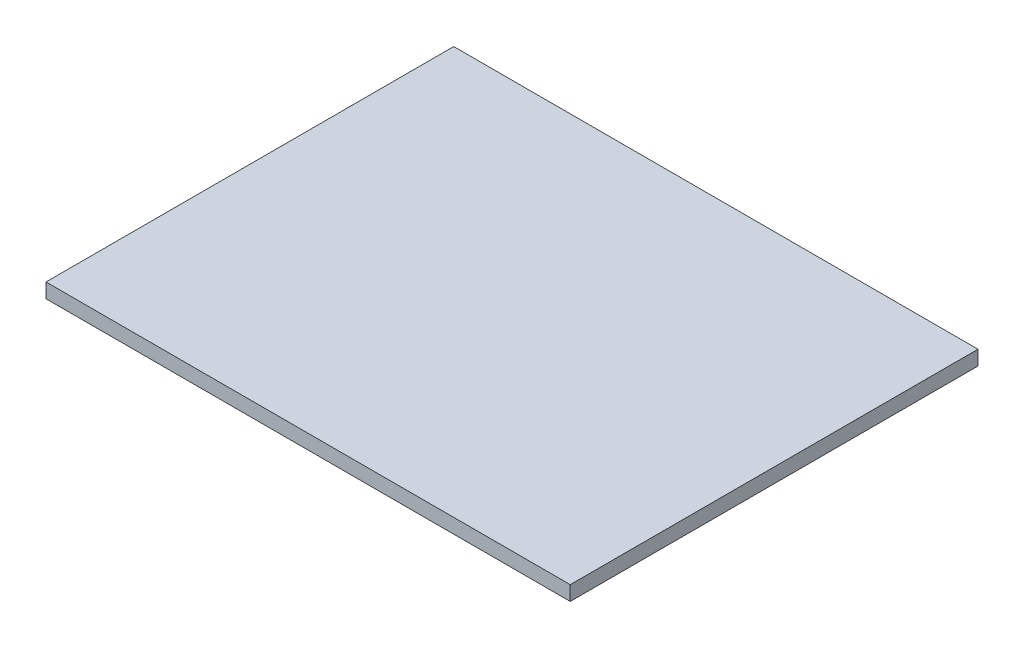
SolidWorks part; units mm, degrees
ref_plane "Alzado" through (0, 0, 0) normal (0, 0, 1) x (1, 0, 0)
ref_plane "Planta" through (0, 0, 0) normal (0, 1, 0) x (1, 0, 0)
ref_plane "Vista lateral" through (0, 0, 0) normal (1, 0, 0) x (0, 0, -1)
sketch "Sketch1" plane through (0, 0, 0) normal (0, 1, 0) x (1, 0, 0)
  line L1 (0, 0) -> (108, 0)
  line L2 (0, 0) -> (0, 84)
  line L3 (0, 84) -> (108, 84)
  line L4 (108, 0) -> (108, 84)
  dimension "D1" = 84
  dimension "D2" = 108
extrude "Boss-Extrude1" add sketch "Sketch1" along normal blind 3
